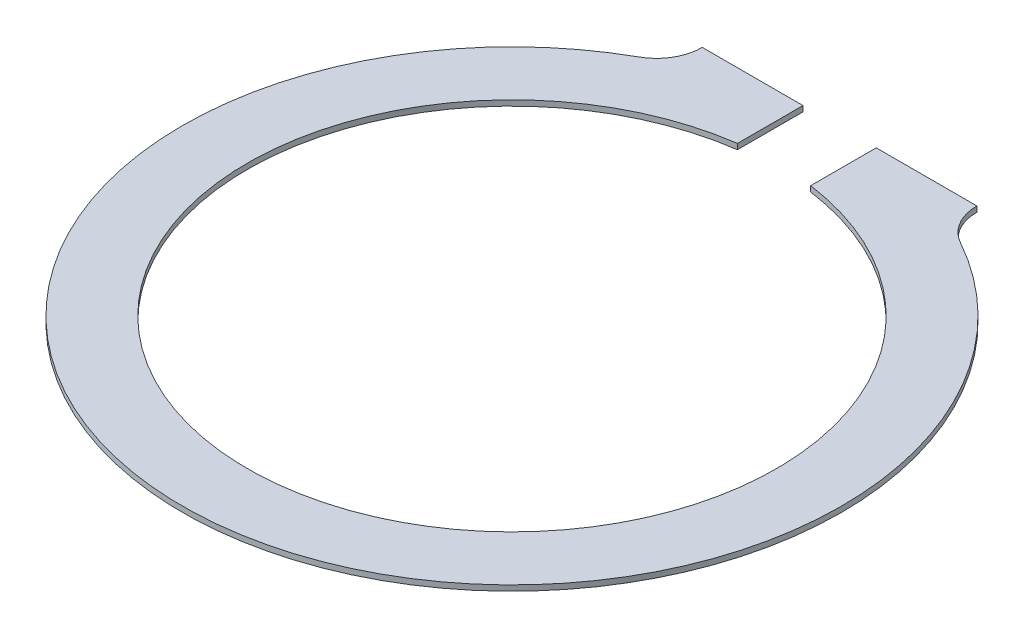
SolidWorks part; units mm, degrees
ref_plane "Front" through (0, 0, 0) normal (0, 0, 1) x (1, 0, 0)
ref_plane "Top" through (0, 0, 0) normal (0, 1, 0) x (1, 0, 0)
ref_plane "Right" through (0, 0, 0) normal (1, 0, 0) x (0, 0, -1)
sketch "Sketch1" plane through (0, 0, 0) normal (0, 1, 0) x (1, 0, 0)
  line L0 (-1.016, 7.2716) -> (-1.016, 9.0911)
  line L1 (1.016, 7.2716) -> (1.016, 9.0911)
  line L2 (3.8097, 9.0911) -> (1.016, 9.0911)
  line L3 (-1.016, 9.0911) -> (-3.8097, 9.0911)
  arc A0 (-4.4602, 7.9824) -> (4.4602, 7.9824) centre (0, 0) ccw
  arc A1 (-4.4602, 7.9824) -> (-3.8097, 9.0911) centre (-5.0797, 9.0911) ccw
  arc A2 (3.8097, 9.0911) -> (4.4602, 7.9824) centre (5.0797, 9.0911) ccw
  arc A3 (-1.016, 7.2716) -> (1.016, 7.2716) centre (0, 0) ccw
extrude "Extrude1" add sketch "Sketch1" along normal blind 0.1524
